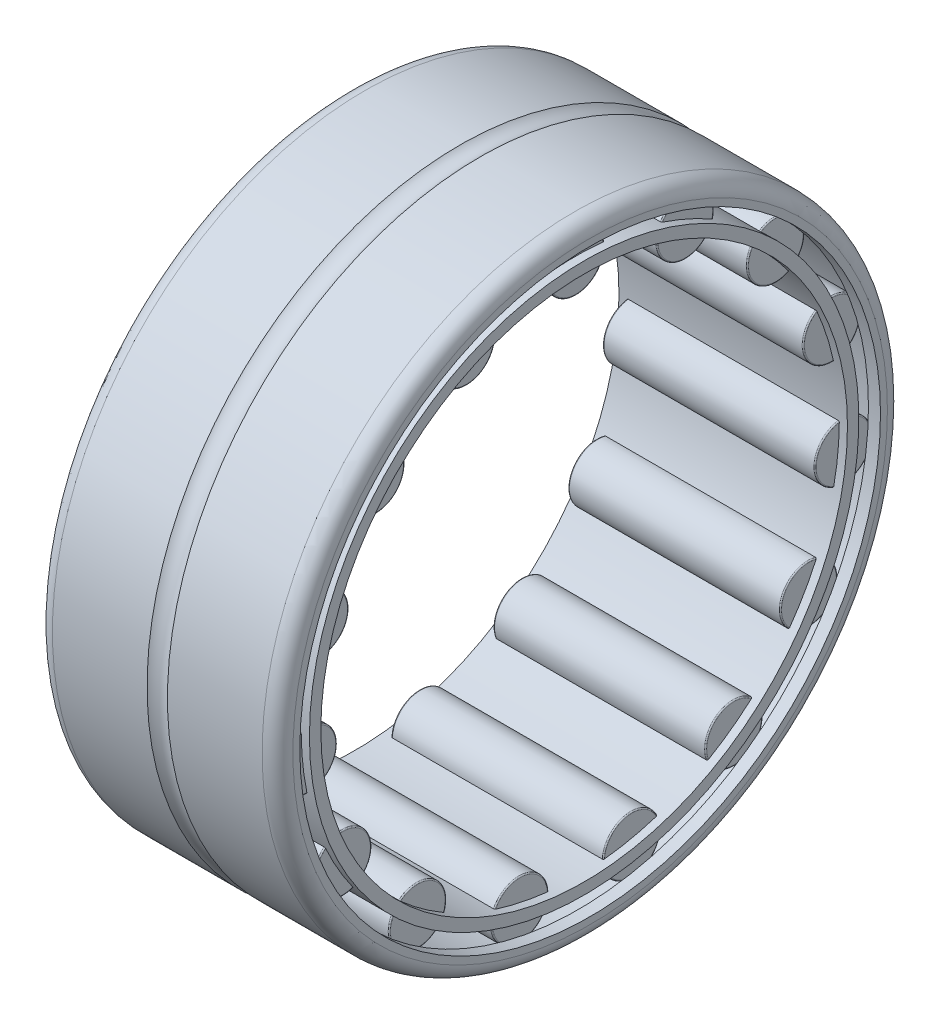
SolidWorks part; units mm, degrees
ref_plane "Plane1" through (0, 0, 0) normal (0, 0, 1) x (1, 0, 0)
ref_plane "Plane2" through (0, 0, 0) normal (0, 1, 0) x (1, 0, 0)
ref_plane "Plane3" through (0, 0, 0) normal (1, 0, 0) x (0, 0, -1)
sketch "Clipboard" plane through (0, 0, 0) normal (0, 0, 1) x (1, 0, 0)
  line L0 (-10, 0) -> (10, 0) construction
  line L1 (41.1529, 1.4371) -> (62.7517, -4.3503)
  line L2 (41.1529, 1.4371) -> (75.4583, 10.6292)
  line L3 (41.1529, 1.4371) -> (62.7517, -4.3503)
  line L4 (41.1529, 1.4371) -> (-22.3471, -0.7804)
  dimension "BallCLRad" = 35.5155
  dimension "Count" = 15
  dimension "Show_count" = 15
  dimension "Max_count" = 15
  dimension "Min_count" = 2
  dimension "Bore" = 63.5
sketch "InnRacSke" plane through (0, 0, 0) normal (0, 0, 1) x (1, 0, 0)
  line L0 (-14.2875, 38.3286) -> (-15.875, 38.3286)
  line L1 (-15.875, 38.3286) -> (-15.875, 39.243)
  line L2 (-13.843, 41.275) -> (-1.344, 41.275)
  line L3 (1.344, 41.275) -> (13.843, 41.275)
  line L4 (15.875, 39.243) -> (15.875, 38.3286)
  line L5 (15.875, 38.3286) -> (14.2875, 38.3286)
  line L6 (14.2875, 38.3286) -> (14.2875, 39.2811)
  line L7 (14.2875, 39.2811) -> (-14.2875, 39.2811)
  line L8 (-14.2875, 39.2811) -> (-14.2875, 38.3286)
  line L9 (-31.75, 0) -> (31.75, 0) construction
  arc A0 (-15.875, 39.243) -> (-13.843, 41.275) centre (-13.843, 39.243) cw
  arc A1 (-1.344, 41.275) -> (1.344, 41.275) centre (0, 42.799) ccw
  arc A2 (13.843, 41.275) -> (15.875, 39.243) centre (13.843, 39.243) cw
  dimension "radius" = 2.032
  dimension "D1" = 78.5622
  dimension "OD" = 82.55
  dimension "Width" = 31.75
  dimension "groove_dp" = 0.9525
  dimension "Cyl_Len" = 28.575
  dimension "offset" = 1.524
  dimension "halfCyl" = 14.2875
revolve "Race" add sketch "InnRacSke" angle 360 about L9
sketch "RolDetSke" plane through (0, 0, 0) normal (0, 0, 1) x (1, 0, 0)
  line L0 (-14.0018, 39.131) -> (-14.0017, 35.5155)
  line L1 (-14.0017, 35.5155) -> (14.0017, 35.5155)
  line L2 (14.0017, 35.5155) -> (14.0018, 39.131)
  line L3 (13.8511, 39.2816) -> (-13.8511, 39.2816)
  line L4 (-28.575, 35.5155) -> (28.575, 35.5155) construction
  arc A0 (14.0018, 39.131) -> (13.8511, 39.2816) centre (13.8511, 39.131) ccw
  arc A1 (-13.8511, 39.2816) -> (-14.0018, 39.131) centre (-13.8511, 39.131) ccw
  dimension "Roller_radius" = 0.1506
  dimension "Roller_diameter" = 7.5321
  dimension "Roller_length" = 28.0035
  dimension "RollerCLRad" = 35.5155
  dimension "halfLength" = 14.0017
revolve "RollerDetailed" add sketch "RolDetSke" angle 360 about L4
ref_axis "Axis1" through (-50, 0, 0) along (1, 0, 0)
sketch "CagSpiSke" plane through (0, 0, 0) normal (0, 0, 1) x (1, 0, 0)
  line L0 (15.0812, 34.7623) -> (15.0812, 36.2688)
  line L1 (15.0812, 36.2688) -> (-15.0813, 36.2688)
  line L2 (-15.0813, 36.2688) -> (-15.0813, 34.7623)
  line L3 (-15.0813, 34.7623) -> (15.0812, 34.7623)
  line L4 (-31.75, 0) -> (31.75, 0) construction
  dimension "Cage_width" = 30.1625
  dimension "D2" = 69.5247
  dimension "Cage_thickness" = 1.5064
  dimension "halfWidth" = 15.0813
revolve "CageSpine" add sketch "CagSpiSke" angle 360 about L4
pattern_circular "RollersDetailed" count 15 every 24 about axis through (-50, 0, 0) along (1, 0, 0) of "RollerDetailed"
sketch "RolSimSke" plane through (0, 0, 0) normal (0, 0, 1) x (1, 0, 0)
  line L0 (-25.4, 0) -> (25.4, 0) construction
  line L2 (-13.8511, 39.2821) -> (13.8511, 39.2821)
  line L3 (-14.0018, 39.1315) -> (-14.0018, 31.9006)
  line L4 (-13.8511, 31.75) -> (13.8511, 31.75)
  line L5 (14.0017, 39.1315) -> (14.0017, 31.9006)
  arc A0 (-14.0018, 31.9006) -> (-13.8511, 31.75) centre (-13.8511, 31.9006) ccw
  arc A1 (-13.8511, 39.2821) -> (-14.0018, 39.1315) centre (-13.8511, 39.1315) ccw
  arc A2 (14.0017, 39.1315) -> (13.8511, 39.2821) centre (13.8511, 39.1315) ccw
  arc A3 (13.8511, 31.75) -> (14.0017, 31.9006) centre (13.8511, 31.9006) ccw
  point P10 (-14.0018, 31.75)
  point P15 (14.0017, 39.2821)
  point P18 (14.0017, 31.75)
  dimension "D1" = 0.1506
  dimension "Bore" = 63.5
  dimension "Roller_length" = 28.0035
  dimension "Roller_diameter" = 7.5321
  dimension "halfWidth" = 14.0017
revolve "RollersSimplified" [suppressed] add sketch "RolSimSke" angle 360 about L0
equation "\"BallCLRad@Clipboard\" =  ( \"D1@InnRacSke\" + \"Bore@Clipboard\" )  / 4"
equation "\"RollerCLRad@RolDetSke\" = \"BallCLRad@Clipboard\""
equation "\"offset@InnRacSke\" = \"radius@InnRacSke\" * .75"
equation "\"halfCyl@InnRacSke\" = \"Cyl_Len@InnRacSke\" / 2"
equation "\"Roller_diameter@RolDetSke\" =  ( \"D1@InnRacSke\" - \"Bore@Clipboard\" )  / 2 + .001"
equation "\"Roller_radius@RolDetSke\" = \"Roller_diameter@RolDetSke\" / 50"
equation "\"Roller_length@RolDetSke\" = \"Cyl_Len@InnRacSke\" * .98"
equation "\"halfLength@RolDetSke\" = \"Roller_length@RolDetSke\" / 2"
equation "\"Cage_width@CagSpiSke\" =  ( \"Cyl_Len@InnRacSke\" + \"Width@InnRacSke\" )  / 2"
equation "\"halfWidth@CagSpiSke\" = \"Cage_width@CagSpiSke\" / 2"
equation "\"Cage_thickness@CagSpiSke\"  = \"Roller_diameter@RolDetSke\" / 5"
equation "\"D2@CagSpiSke\" =  \"RollerCLRad@RolDetSke\" * 2 - \"Cage_thickness@CagSpiSke\""
equation "\"Roller_length@RolSimSke\" = \"Cyl_Len@InnRacSke\" * .98"
equation "\"halfWidth@RolSimSke\" = \"Roller_length@RolSimSke\" / 2"
equation "\"D1@RolSimSke\" = \"Roller_radius@RolDetSke\""
equation "\"Roller_diameter@RolSimSke\" =  ( \"D1@InnRacSke\" - \"Bore@Clipboard\" )  / 2 + .001"
equation "\"Max_count@Clipboard\" = int( 3.14159265 / atn(( \"Roller_diameter@RolDetSke\" / 2) / sqr( \"RollerCLRad@RolDetSke\"  *  \"RollerCLRad@RolDetSke\" - ( \"Roller_diameter@RolDetSke\" / 2) *  ( \"Roller_diameter@R"
equation "\"Max_count@Clipboard\" = ((sgn( \"Max_count@Clipboard\" - \"Count@Clipboard\" )-1)*( \"Max_count@Clipboard\" - \"Count@Clipboard\" ))/-2+ \"Count@Clipboard\""
equation "\"Count@RollersDetailed\" = int( \"Show_count@Clipboard\" ) "
equation "\"Count@RollersDetailed\" = ((sgn( \"Count@RollersDetailed\" - \"Max_count@Clipboard\" )-1)*( \"Count@RollersDetailed\" - \"Max_count@Clipboard\" ))/-2+ \"Max_count@Clipboard\""
equation "\"Count@RollersDetailed\" = ((sgn( \"Count@RollersDetailed\" - \"Min_count@Clipboard\" )+1)*( \"Count@RollersDetailed\" - \"Min_count@Clipboard\"))/2 +\"Min_count@Clipboard\""
equation "\"Angle@RollersDetailed\" = 360.0 / \"Max_count@Clipboard\""
equation "\"Angle@CageSpine\" =  \"Angle@RollersDetailed\" * ( \"Count@RollersDetailed\" -1 + int( \"Count@RollersDetailed\" / \"Max_count@Clipboard\" ) )  + 0.001 -  int( \"Count@RollersDetailed\" / \"Max_count@Clipboard\" "
equation "\"Angle@CageSpine\" =  \"Angle@CageSpine\" * int( \"Min_count@Clipboard\" / 2) + int(1 / \"Min_count@Clipboard\")  * 0.001"
equation "\"Bore@RolSimSke\" = \"Bore@Clipboard\""
